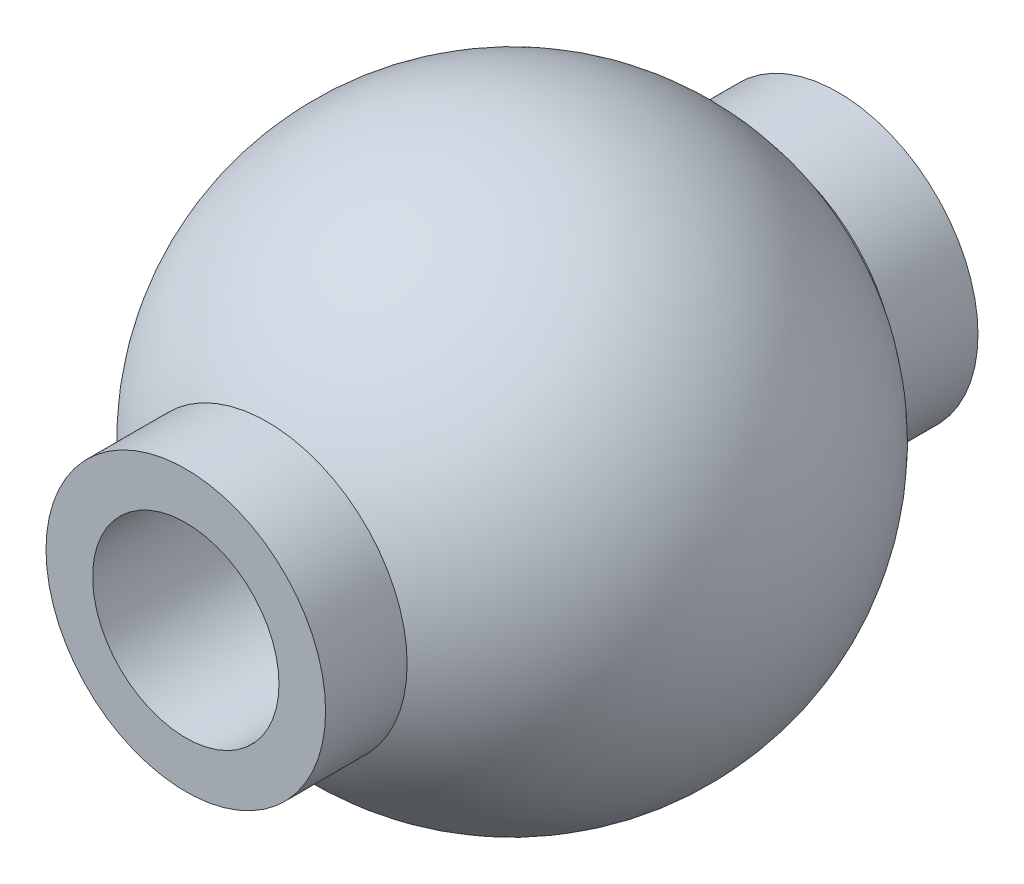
SolidWorks part; units mm, degrees
ref_plane "Face" through (0, 0, 0) normal (0, 0, 1) x (1, 0, 0)
ref_plane "Dessus" through (0, 0, 0) normal (0, 1, 0) x (1, 0, 0)
ref_plane "Droite" through (0, 0, 0) normal (1, 0, 0) x (0, 0, -1)
sketch "Esquisse1" plane through (0, 0, 0) normal (0, 0, 1) x (1, 0, 0)
  circle A0 centre (0, 0) radius 6
  dimension "D1" = 12
sketch "Esquisse2" plane through (0, 0, 0) normal (0, 1, 0) x (1, 0, 0)
  circle A0 centre (0, 0) radius 6
  dimension "D1" = 12
sweep "Base-Balayage" add profiles "Esquisse2" path "Esquisse1"
ref_plane "Plan1" through (0, 0, 7) normal (0, 0, 1) x (1, 0, 0)
sketch "Esquisse3" plane through (0, 0, 7) normal (0, 0, 1) x (1, 0, 0)
  circle A0 centre (0, 0) radius 3
  dimension "D1" = 6
extrude "Boss.-Extru.2" add sketch "Esquisse3" against normal blind 1.75
mirror "Symétrie1" about plane through (0, 0, 0) normal (0, 0, 1)
sketch "Esquisse4" plane through (0, 0, 7) normal (0, 0, 1) x (1, 0, 0)
  circle A0 centre (0, 0) radius 2
  dimension "D1" = 4
extrude "Enlèv. mat.-Extru.1" cut sketch "Esquisse4" against normal through all
